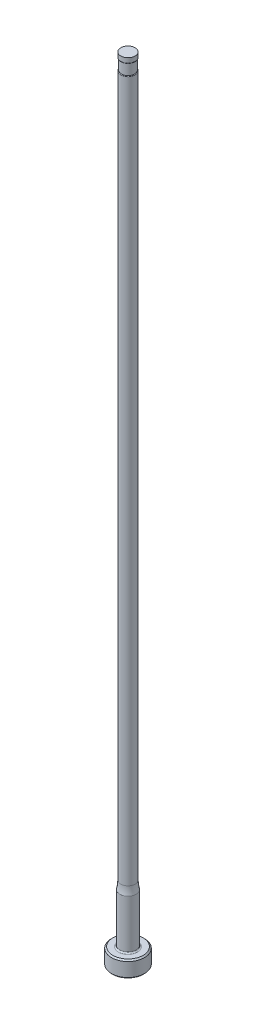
SolidWorks part; units mm, degrees
ref_plane "Front Plane" through (0, 0, 0) normal (0, 0, 1) x (1, 0, 0)
ref_plane "Top Plane" through (0, 0, 0) normal (0, 1, 0) x (1, 0, 0)
ref_plane "Right Plane" through (0, 0, 0) normal (1, 0, 0) x (0, 0, -1)
other "Configuration Table"
sketch "Sketch1" plane through (0, 0, 0) normal (0, 0, 1) x (1, 0, 0)
  line L0 (0, 259.9588) -> (0, -15.1925) construction
  line L1 (0, 0) -> (-3.175, 0)
  line L2 (-3.175, 0) -> (-3.175, 3.175)
  line L3 (-3.175, 3.175) -> (-1.5875, 3.175)
  line L4 (-1.3881, 14.2788) -> (-1.3881, 152.4)
  line L5 (-1.3881, 152.4) -> (0, 152.4)
  line L6 (0, 152.4) -> (0, 0)
  line L7 (-1.5875, 3.175) -> (-1.5875, 12.7)
  arc A1 (-1.5875, 12.7) -> (-1.3881, 14.2788) centre (-7.7381, 14.2788) ccw
  dimension "D1" = 6.35
  dimension "L" = 152.4
  dimension "D2" = 3.175
  dimension "H" = 6.35
  dimension "T" = 3.175
  dimension "D" = 2.7762
  dimension "S" = 12.7
revolve "Revolve1" add sketch "Sketch1" angle 360 about L0
chamfer "Chamfer1" distance 0.254 angle 45 2 edges at (0, 3.175, 3.175) (0, 0, 3.175)
fillet "Fillet1" radius 0.254 1 edges at (0, 3.175, 1.5875)
sketch "Sketch2" plane through (0, 0, 0) normal (0, 0, 1) x (1, 0, 0)
  line L0 (-1.3881, 152.4) -> (-1.3881, 14.2788) construction
  line L1 (-1.3881, 151.384) -> (-1.2865, 151.384)
  line L2 (-1.3881, 151.384) -> (-1.3881, 149.352)
  line L3 (-1.3881, 149.352) -> (-1.2865, 149.352)
  line L4 (-1.2865, 151.384) -> (-1.2865, 149.352)
  line L5 (1.3881, 152.4) -> (-1.3881, 152.4) construction
  line L6 (0, 153.4483) -> (0, 147.3282) construction
  dimension "D1" = 2.032
  dimension "N" = 1.016
  dimension "FD" = 0.1016
  dimension "D3" = 2.573
revolve "Vent Relief" cut sketch "Sketch2" angle 360 about L6
sketch "Sketch3" plane through (0, 0, 0) normal (0, 0, 1) x (1, 0, 0)
  line L0 (-1.2865, 150.368) -> (-1.2865, 112.268)
  line L1 (-1.2865, 151.384) -> (-1.2865, 149.352) construction
  line L2 (-1.3881, 149.352) -> (-1.3881, 14.2788) construction
  line L3 (-1.3881, 111.4712) -> (-1.3881, 150.368)
  line L4 (-1.3881, 150.368) -> (-1.2865, 150.368)
  arc A0 (-1.2865, 112.268) -> (-1.3881, 111.4712) centre (-4.4615, 112.268) cw
  dimension "D1" = 3.175
  dimension "D2" = 38.1
extrude "D-Slot" cut sketch "Sketch3" against normal through all both and the other way through all
sketch "Sketch5" plane through (0, 0, 0) normal (0, 0, 1) x (1, 0, 0)
  line L0 (-1.3881, 151.384) -> (1.3881, 151.384) construction
  line L1 (-1.3881, 152.4) -> (-1.383, 152.4)
  line L2 (-1.3881, 152.4) -> (-1.3881, 151.384)
  line L3 (-1.3881, 151.384) -> (-1.383, 151.384)
  line L4 (-1.383, 152.4) -> (-1.383, 151.384)
  line L5 (0, 152.6877) -> (0, 150.5771) construction
  dimension "VP" = 0.0051
revolve "Vent Diameter" cut sketch "Sketch5" angle 360 about L5
fillet "Fillet2" radius 0.127 2 edges at (1.3881, 149.352, 0) (0, 151.384, 1.383)
sketch "Pocket Sketch" plane through (0, 0, 0) normal (0, 0, 1) x (1, 0, 0)
  line L0 (-3.5719, 0) -> (-3.5719, 3.2004)
  line L1 (-3.5719, 3.2004) -> (-2.3485, 3.2004)
  line L2 (-1.5865, 3.9624) -> (-1.5865, 22.225)
  line L3 (-1.5865, 22.225) -> (0, 22.225)
  line L4 (0, 22.225) -> (0, 0)
  line L5 (0, 0) -> (-3.5719, 0)
  line L6 (0, 12.6104) -> (0, -2.4989) construction
  line L7 (-3.175, 2.921) -> (-3.175, 0.254) construction
  line L8 (2.921, 3.175) -> (-2.921, 3.175) construction
  line L9 (-1.3881, 111.4712) -> (-1.3881, 14.2788) construction
  line L10 (-2.3485, 3.2004) -> (-1.5865, 3.9624)
  point P3 (-1.5865, 3.2004)
  dimension "D1" = 7.1437
  dimension "D2" = 0.3969
  dimension "D3" = 0.0254
  dimension "D4" = 0.1984
  dimension "D5" = 3.1731
  dimension "D6" = 22.225
